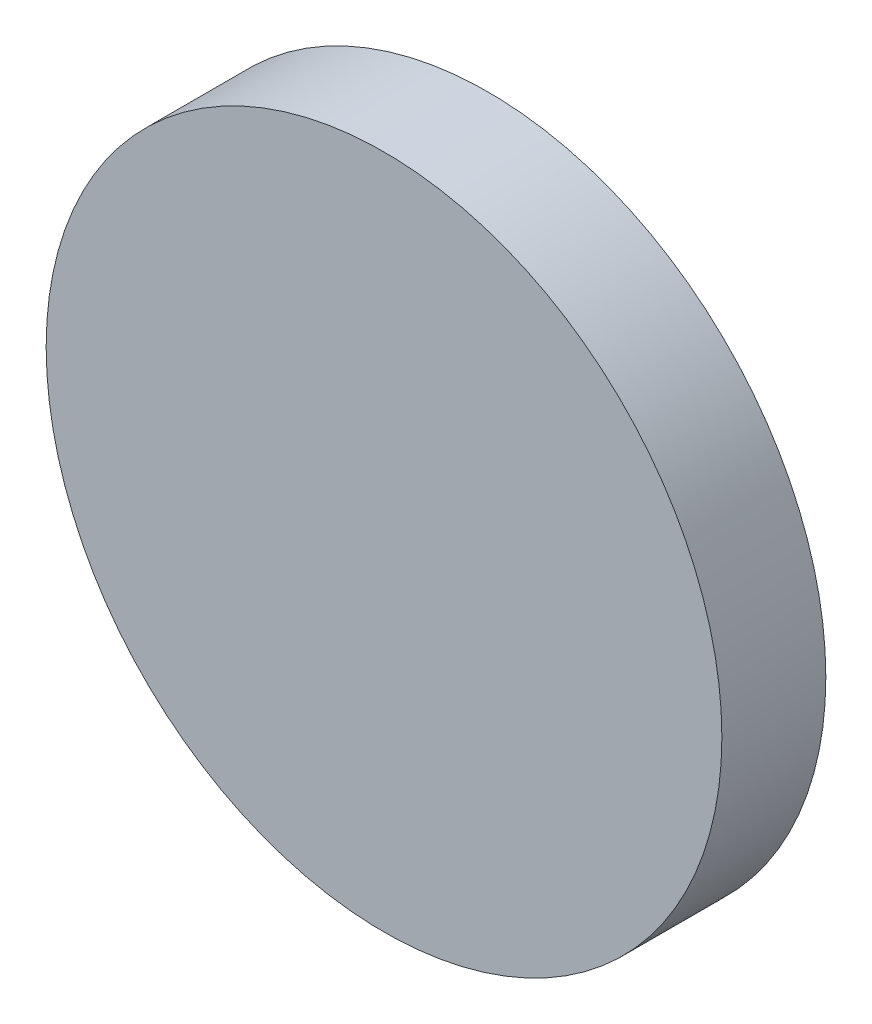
SolidWorks part; units mm, degrees
ref_plane "Plan1" through (0, 0, 0) normal (0, 0, 1) x (1, 0, 0)
ref_plane "Plan2" through (0, 0, 0) normal (0, 1, 0) x (1, 0, 0)
ref_plane "Plan3" through (0, 0, 0) normal (1, 0, 0) x (0, 0, -1)
sketch "Esquisse1" plane through (0, 0, 0) normal (0, 0, 1) x (1, 0, 0)
  circle A0 centre (0, 0) radius 6.5
  dimension "D1" = 13
extrude "Base-Extrusion" add sketch "Esquisse1" along normal blind 2
